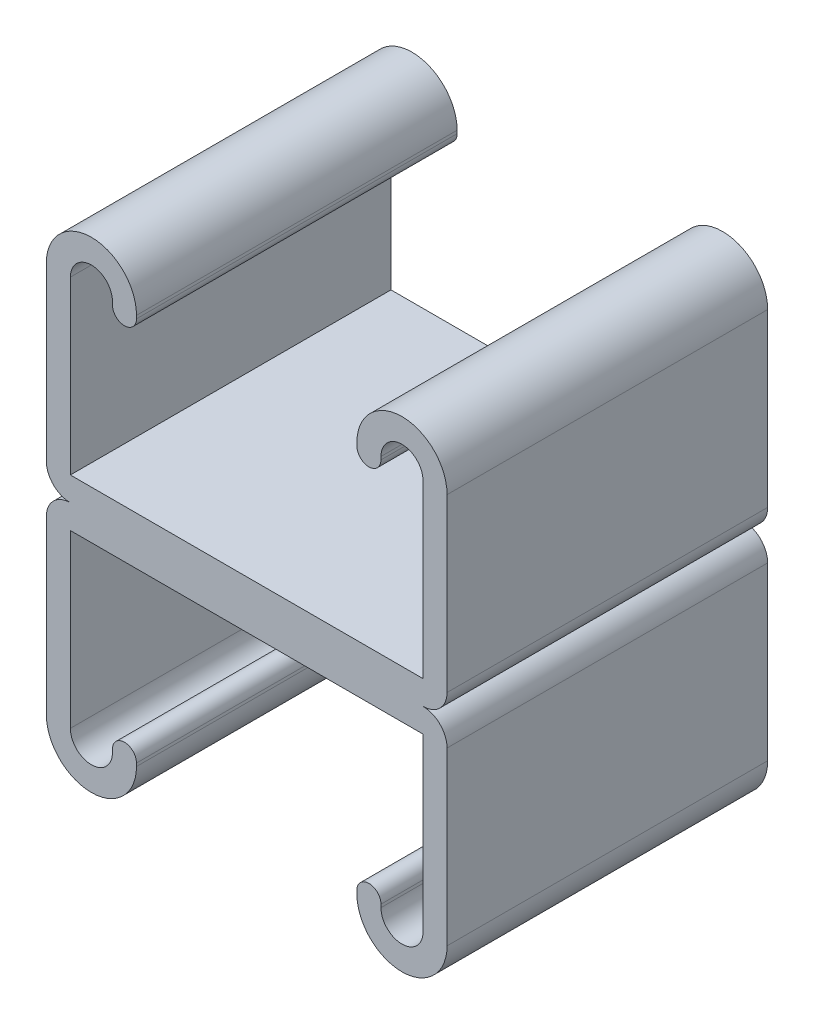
SolidWorks part; units mm, degrees
ref_plane "Plane1" through (0, 0, 0) normal (0, 0, 1) x (1, 0, 0)
ref_plane "Plane2" through (0, 0, 0) normal (0, 1, 0) x (1, 0, 0)
ref_plane "Plane3" through (0, 0, 0) normal (1, 0, 0) x (0, 0, -1)
sketch "Sketch1" plane through (0, 0, 0) normal (0, 0, 1) x (1, 0, 0)
  line L0 (-15.875, 15.4781) -> (-15.875, 1.905)
  line L1 (-13.97, 0) -> (13.97, 0)
  line L2 (15.875, 1.905) -> (15.875, 15.4781)
  line L3 (8.7312, 15.4781) -> (8.7312, 15.24)
  line L4 (-8.7313, 15.4781) -> (-8.7313, 15.24)
  line L5 (-10.6363, 15.4781) -> (-10.6363, 15.24)
  line L6 (-13.97, 15.4781) -> (-13.97, 1.905)
  line L7 (-13.97, 1.905) -> (13.97, 1.905)
  line L8 (13.97, 1.905) -> (13.97, 15.4781)
  line L9 (10.6362, 15.4781) -> (10.6362, 15.24)
  line L10 (-25.4, 19.05) -> (25.4, 19.05) construction
  line L11 (-12.8524, 14.2875) -> (12.8524, 14.2875) construction
  arc A0 (15.875, 15.4781) -> (8.7312, 15.4781) centre (12.3031, 15.4781) ccw
  arc A1 (-15.875, 15.4781) -> (-8.7313, 15.4781) centre (-12.3031, 15.4781) cw
  arc A2 (-13.97, 0) -> (-15.875, 1.905) centre (-13.97, 1.905) cw
  arc A3 (13.97, 0) -> (15.875, 1.905) centre (13.97, 1.905) ccw
  arc A4 (-13.97, 15.4781) -> (-10.6363, 15.4781) centre (-12.3031, 15.4781) cw
  arc A5 (13.97, 15.4781) -> (10.6362, 15.4781) centre (12.3031, 15.4781) ccw
  arc A6 (8.7312, 15.24) -> (10.6362, 15.24) centre (9.6837, 15.24) ccw
  arc A7 (-8.7313, 15.24) -> (-10.6363, 15.24) centre (-9.6838, 15.24) cw
  dimension "D1" = 1.905
  dimension "Width" = 31.75
  dimension "D6" = 7.1437
  dimension "D7" = 17.4625
  dimension "D9" = 4.7625
  dimension "D2" = 19.05
  dimension "gauge" = 1.905
extrude "Base-Extrude" add sketch "Sketch1" along normal mid plane 25.4
mirror "Mirror1" about plane through (0, 0, 0) normal (0, 1, 0) of "Base-Extrude"
equation "\"D7@Sketch1\" = \"Width@Sketch1\" - 2 * \"D6@Sketch1\""
equation "\"D1@Sketch1\" = \"gauge@Sketch1\""
